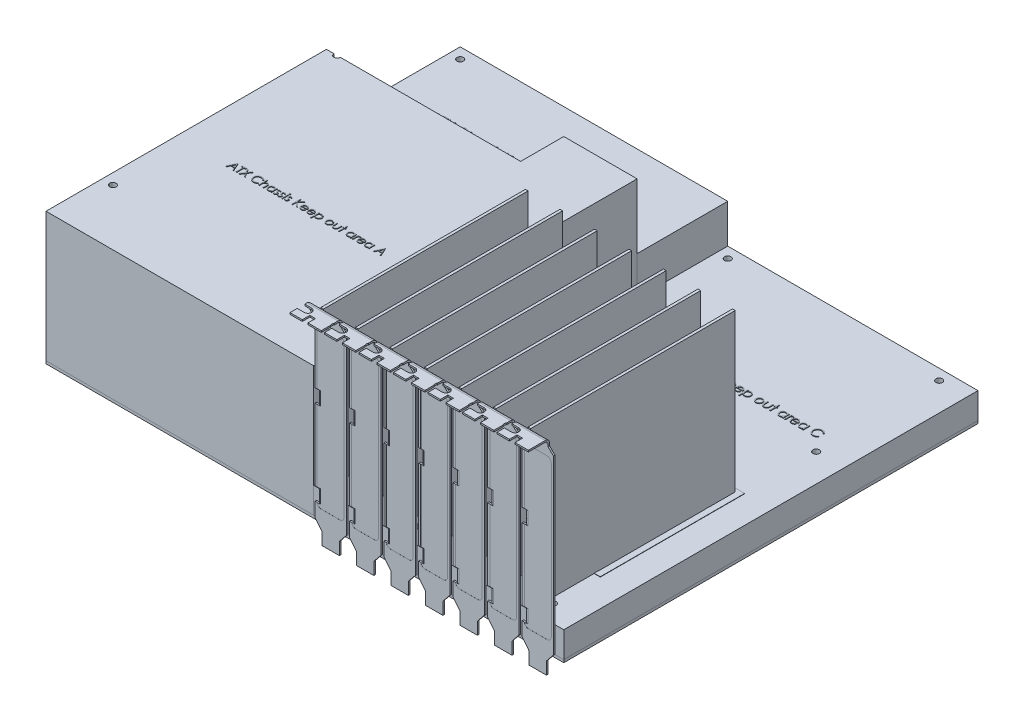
SolidWorks part; units mm, degrees
ref_plane "Front Plane" through (0, 0, 0) normal (0, 0, 1) x (1, 0, 0)
ref_plane "Top Plane" through (0, 0, 0) normal (0, 1, 0) x (1, 0, 0)
ref_plane "Right Plane" through (0, 0, 0) normal (1, 0, 0) x (0, 0, -1)
sketch "MINI ITX" plane through (0, 0, 0) normal (0, 1, 0) x (1, 0, 0)
  line L1 (0, 0) -> (-170, 0)
  line L2 (0, 0) -> (0, 170)
  line L3 (0, 170) -> (-170, 170)
  line L4 (-170, 0) -> (-170, 170)
  dimension "D1" = 170
  dimension "D2" = 170
extrude "MINI-ITX" add sketch "MINI ITX" along normal blind 1.5875
sketch "IO PLATE"
  line L0 (-13.563, 42.3545) -> (-172.567, 42.3545)
  line L1 (-13.69, 42.2275) -> (-172.44, 42.2275) construction
  line L2 (-13.69, 42.2275) -> (-13.69, -2.2225) construction
  line L3 (-13.69, -2.2225) -> (-172.44, -2.2225) construction
  line L4 (-172.44, 42.2275) -> (-172.44, -2.2225) construction
  line L5 (-170, 1.5875) -> (0, 1.5875) construction
  line L6 (-172.567, 42.3545) -> (-172.567, -2.3495)
  line L7 (-13.563, -2.3495) -> (-172.567, -2.3495)
  line L8 (-13.563, 42.3545) -> (-13.563, -2.3495)
other "AlignGroup3" parameters "D1"=0, "D2"=0, "D3"=156.31, "D4"=2.44, "D5"=40.64, "D6"=3.81, "D7"=0.127
other "AlignGroup4"
sketch "Sketch1"
  circle A0 centre (163.83, -33.02) radius 1.905
  circle A1 centre (6.35, -10.16) radius 1.905
  circle A2 centre (6.35, -165.1) radius 1.905
  circle A3 centre (163.83, -165.1) radius 1.905
other "AlignGroup1" parameters "D1"=10.595, "D2"=0, "D3"=0, "D4"=6.35, "D5"=163.4722, "D6"=10.16, "D7"=32.893, "D8"=164.8438
other "AlignGroup2"
extrude "MINI-ITX HOLES" [suppressed] cut sketch "Sketch1" against normal through all
sketch "MICRO ATX" plane through (0, 0, 0) normal (0, 1, 0) x (1, 0, 0)
  line L1 (-170, 0) -> (73.84, 0)
  line L2 (-170, 0) -> (-170, 243.84)
  line L3 (-170, 243.84) -> (73.84, 243.84)
  line L4 (73.84, 0) -> (73.84, 243.84)
  dimension "D1" = 243.84
  dimension "D2" = 243.84
  dimension "D3" = 170
extrude "MICRO-ATX" add sketch "MICRO ATX" along normal blind 1.5875
sketch "Sketch6" plane through (0, 1.5875, 0) normal (0, 1, 0) x (1, 0, 0)
  line L0 (-170, 0) -> (73.84, 0) construction
  line L1 (73.84, 0) -> (-170, 0)
  line L2 (73.84, 0) -> (73.84, 190.5)
  line L3 (73.84, 190.5) -> (-170, 190.5)
  line L4 (-170, 0) -> (-170, 190.5)
  dimension "D1" = 243.84
  dimension "D2" = 190.5
extrude "FLEX-ATX" add sketch "Sketch6" against normal blind 1.5875
sketch "ATX" plane through (0, 0, 0) normal (0, 1, 0) x (1, 0, 0)
  line L1 (-170, 0) -> (134.8, 0)
  line L2 (-170, 0) -> (-170, 243.84)
  line L3 (-170, 243.84) -> (134.8, 243.84)
  line L4 (134.8, 0) -> (134.8, 243.84)
  dimension "D1" = 304.8
  dimension "D2" = 243.84
extrude "ATX-" add sketch "ATX" along normal blind 1.5875
sketch "E ATX" plane through (0, 0, 0) normal (0, 1, 0) x (1, 0, 0)
  line L1 (-170, 0) -> (134.8, 0)
  line L2 (-170, 0) -> (-170, 330.2)
  line L3 (-170, 330.2) -> (134.8, 330.2)
  line L4 (134.8, 0) -> (134.8, 330.2)
  dimension "D1" = 304.8
  dimension "D2" = 330.2
extrude "E-ATX" [suppressed] add sketch "E ATX" along normal blind 1.5875
sketch "Sketch7"
  circle A0 centre (39.37, 10.033) radius 1.905
  circle A1 centre (39.37, 164.8438) radius 1.905
  circle A3 centre (-163.4722, 32.893) radius 1.905
  circle A4 centre (-6.35, 10.033) radius 1.905
  circle A5 centre (-163.4722, 164.8438) radius 1.905
  circle A6 centre (-6.35, 164.8438) radius 1.905
other "AlignGroup9" parameters "D1"=9.7201, "D2"=3.81, "D3"=0, "D4"=0, "D5"=237.3122, "D6"=32.893, "D7"=164.8438, "D8"=10.033, "D9"=80.19
other "AlignGroup10"
extrude "FLEX ATX HOLES" [suppressed] cut sketch "Sketch7" against normal through all
sketch "MINI ATX" plane through (0, 0, 0) normal (0, 1, 0) x (1, 0, 0)
  line L1 (-170, 0) -> (114.48, 0)
  line L2 (-170, 0) -> (-170, 208.28)
  line L3 (-170, 208.28) -> (114.48, 208.28)
  line L4 (114.48, 0) -> (114.48, 208.28)
  dimension "D1" = 284.48
  dimension "D2" = 208.28
  dimension "D3" = 170
sketch "Sketch3" plane through (0, 0, 0) normal (0, 1, 0) x (1, 0, 0)
  line L2 (73.84, 0) -> (73.84, 243.84) construction
  line L5 (-170, 0) -> (114.48, 0) construction
  circle A0 centre (39.55, 10.16) radius 1.905
  circle A1 centre (-6.17, 10.16) radius 1.905
  circle A2 centre (59.87, 165.1) radius 1.905
  circle A3 centre (39.55, 165.1) radius 1.905
  circle A4 centre (-6.17, 165.1) radius 1.905
  circle A5 centre (-6.17, 237.49) radius 1.905
  circle A6 centre (-163.65, 237.49) radius 1.905
  circle A7 centre (-163.65, 165.1) radius 1.905
  circle A8 centre (-163.65, 33.02) radius 1.905
  dimension "D1" = 3.81
  dimension "D2" = 45.72
  dimension "D3" = 34.29
  dimension "D4" = 22.86
  dimension "D5" = 10.16
  dimension "D6" = 203.2
  dimension "D7" = 154.94
  dimension "D8" = 20.32
  dimension "D9" = 227.33
extrude "MICRO-ATX HOLES" [suppressed] cut sketch "Sketch3" along normal through all
sketch "Sketch4"
  line L0 (134.8, 0) -> (134.8, 243.84) construction
  line L1 (-170, 0) -> (134.8, 0) construction
  circle A0 centre (118.29, 10.16) radius 1.905
  circle A1 centre (118.29, 165.1) radius 1.905
  circle A2 centre (118.29, 237.49) radius 1.905
  circle A4 centre (-6.17, 10.16) radius 1.905
  circle A5 centre (-163.65, 33.02) radius 1.905
  circle A6 centre (-163.65, 165.1) radius 1.905
  circle A7 centre (-6.17, 165.1) radius 1.905
  circle A8 centre (-163.65, 237.49) radius 1.905
  circle A9 centre (-6.17, 237.49) radius 1.905
  circle A10 centre (39.55, 10.16) radius 1.905
other "AlignGroup11" parameters "D1"=3.81, "D2"=11.444, "D3"=243.84, "D4"=0, "D5"=140.97, "D6"=298.45, "D7"=33.02, "D8"=165.1, "D9"=237.49, "D10"=10.16, "D11"=78.74, "D12"=16.51
other "AlignGroup12"
extrude "ATX HOLES" cut sketch "Sketch4" against normal through all
sketch "Sketch8" plane through (0, 1.5875, 0) normal (0, 1, 0) x (1, 0, 0)
  line L0 (134.8, 0) -> (134.8, 243.84) construction
  line L1 (-170, 0) -> (134.8, 0) construction
  circle A0 centre (118.29, 10.16) radius 1.905
  circle A1 centre (-6.17, 10.16) radius 1.905
  circle A2 centre (118.29, 165.1) radius 1.905
  circle A3 centre (-6.17, 165.1) radius 1.905
  circle A4 centre (-163.65, 165.1) radius 1.905
  circle A5 centre (-163.65, 33.02) radius 1.905
  circle A6 centre (-163.65, 322.58) radius 1.905
  circle A7 centre (-6.17, 322.58) radius 1.905
  circle A8 centre (123.37, 322.58) radius 1.905
  circle A9 centre (118.29, 237.49) radius 1.905
  circle A10 centre (39.55, 187.96) radius 1.905
  dimension "D1" = 3.81
  dimension "D2" = 16.51
  dimension "D3" = 124.46
  dimension "D4" = 10.16
  dimension "D5" = 154.94
  dimension "D6" = 227.33
  dimension "D7" = 177.8
  dimension "D8" = 5.08
  dimension "D9" = 312.42
  dimension "D10" = 281.94
  dimension "D11" = 22.86
  dimension "D12" = 78.74
extrude "E-ATX HOLES" [suppressed] cut sketch "Sketch8" against normal through all
sketch "Sketch9"
  line L1 (-12.106, 122.555) -> (-3.216, 122.555)
  line L2 (-12.106, 122.555) -> (-12.106, 37.592)
  line L3 (-12.106, 37.592) -> (-3.216, 37.592)
  line L4 (-3.216, 122.555) -> (-3.216, 37.592)
  line L5 (-8.5881, 120.1547) -> (-6.7339, 120.1547)
  line L6 (-8.5881, 120.1547) -> (-8.5881, 105.0925)
  line L7 (-8.5881, 105.0925) -> (-6.7339, 105.0925)
  line L8 (-6.7339, 120.1547) -> (-6.7339, 105.0925)
  line L9 (-6.7339, 103.4923) -> (-8.5881, 103.4923)
  line L10 (-6.7339, 103.4923) -> (-6.7339, 39.9923)
  line L11 (-6.7339, 39.9923) -> (-8.5881, 39.9923)
  line L12 (-8.5881, 103.4923) -> (-8.5881, 39.9923)
other "AlignGroup13" parameters "D1"=0, "D2"=0, "D3"=3.5179, "D4"=5.3721, "D5"=2.4003, "D6"=65.9003, "D7"=67.5005, "D8"=82.5627, "D9"=8.89, "D10"=84.963, "D11"=0, "D12"=0, "D13"=3.216, "D14"=37.592, "D15"=3.216, "D16"=37.592
other "AlignGroup14"
extrude "PCI SLOT 1" add sketch "Sketch9" along normal blind 15.4178
sketch "Sketch11"
  line L1 (-8.4484, 120.6794) -> (-6.8609, 120.6794)
  line L2 (-8.4484, 120.6794) -> (-8.4484, 0.2794)
  line L3 (-8.4484, 0.2794) -> (-6.8609, 0.2794)
  line L4 (-6.8609, 120.6794) -> (-6.8609, 0.2794)
other "AlignGroup15" parameters "D1"=0, "D2"=0, "D3"=6.8609, "D4"=8.4484, "D5"=0.2794, "D6"=120.6794
other "AlignGroup16"
extrude "Extrude1" add sketch "Sketch11" along normal blind 107.7976
sketch "Sketch12"
  line L1 (1.143, 68.1863) -> (-9.0424, 68.1863)
  line L2 (1.143, 68.1863) -> (1.143, 60.3123)
  line L3 (1.143, 60.3123) -> (-9.0424, 60.3123)
  line L4 (-10.3124, 66.9163) -> (-10.3124, 61.5823)
  line L5 (1.143, 18.1483) -> (-9.0424, 18.1483)
  line L6 (1.143, 18.1483) -> (1.143, 10.2743)
  line L7 (1.143, 10.2743) -> (-9.0424, 10.2743)
  line L8 (-10.3124, 16.8783) -> (-10.3124, 11.5443)
  line L11 (-0.2794, 109.3851) -> (-0.2794, 1.5875) construction
  arc A0 (-9.0424, 68.1863) -> (-10.3124, 66.9163) centre (-9.0424, 66.9163) ccw
  arc A1 (-10.3124, 61.5823) -> (-9.0424, 60.3123) centre (-9.0424, 61.5823) ccw
  arc A2 (-10.3124, 16.8783) -> (-9.0424, 18.1483) centre (-9.0424, 16.8783) cw
  arc A3 (-10.3124, 11.5443) -> (-9.0424, 10.2743) centre (-9.0424, 11.5443) ccw
  point P10 (-10.3124, 64.2493)
other "AlignGroup17" parameters "D1"=1.27, "D2"=0, "D3"=0, "D4"=1.143, "D5"=10.3124, "D6"=18.1483, "D7"=60.3123, "D8"=64.2493, "D9"=68.1863
other "AlignGroup18"
extrude "Extrude2" add sketch "Sketch12" along normal blind 0.9144
sketch "Sketch13"
  line L0 (-10.4931, 2.0193) -> (-6.3783, -3.0607)
  line L1 (-10.4931, 103.4923) -> (7.9219, 103.4923) construction
  line L2 (-10.4931, 103.4923) -> (-10.4931, 2.0193)
  line L3 (-10.4931, 2.0193) -> (7.9219, 2.0193) construction
  line L4 (7.9219, 103.4923) -> (7.9219, 2.0193)
  line L5 (-6.3783, -3.0607) -> (-6.3783, -10.2997)
  line L6 (-6.3783, -10.2997) -> (3.8071, -10.2997)
  line L7 (3.8071, -10.2997) -> (3.8071, -3.0607)
  line L8 (3.8071, -3.0607) -> (7.9219, 2.0193)
  line L9 (-10.4931, 103.4923) -> (-13.6681, 106.6673)
  line L10 (-13.6681, 106.6673) -> (-13.6681, 110.6297)
  line L11 (-13.6681, 110.6297) -> (4.7469, 110.6297)
  line L12 (4.7469, 110.6297) -> (4.7469, 106.6673)
  line L13 (4.7469, 106.6673) -> (7.9219, 103.4923)
other "AlignGroup19" parameters "D1"=0, "D2"=0, "D3"=3.8071, "D4"=4.7469, "D5"=7.9219, "D6"=6.3783, "D7"=10.4931, "D8"=13.6681, "D9"=106.6673, "D10"=110.6297, "D11"=3.0607, "D12"=10.2997
other "AlignGroup20"
extrude "Extrude3" add sketch "Sketch13" against normal blind 0.9144
sketch "Sketch14" plane through (0, 0, 1.143) normal (0, 0, 1) x (1, 0, 0)
  line L0 (-13.6681, 110.6297) -> (-13.6681, 106.6673) construction
  line L1 (4.7469, 110.6297) -> (-13.6681, 110.6297)
  line L2 (4.7469, 110.6297) -> (4.7469, 109.7153)
  line L3 (4.7469, 109.7153) -> (-13.6681, 109.7153)
  line L4 (-13.6681, 110.6297) -> (-13.6681, 109.7153)
  dimension "D1" = 0.9144
extrude "Extrude4" add sketch "Sketch14" along normal blind 11.557
sketch "Sketch15"
  line L0 (4.7469, -12.7) -> (-13.6681, -12.7) construction
  line L1 (-6.4291, -8.255) -> (-3.1271, -8.255)
  line L2 (-6.4291, -8.255) -> (-6.4291, -12.7)
  line L3 (-6.4291, -12.7) -> (-3.1271, -12.7)
  line L4 (-3.1271, -8.255) -> (-3.1271, -12.7)
  line L6 (-9.6041, -6.223) -> (-13.6681, -6.223) construction
  line L7 (-9.6041, -4.0132) -> (-13.6681, -4.0132)
  line L8 (-9.6041, -8.4328) -> (-13.6681, -8.4328)
  line L10 (-13.6681, -0.2286) -> (-13.6681, -12.7) construction
  arc A0 (-9.6041, -4.0132) -> (-9.6041, -8.4328) centre (-9.6041, -6.223) cw
  arc A1 (-13.6681, -4.0132) -> (-13.6681, -8.4328) centre (-13.6681, -6.223) ccw
other "AlignGroup21" parameters "D4"=2.2098, "D1"=0, "D3"=0, "D5"=3.1271, "D6"=6.4291, "D7"=9.6041, "D8"=6.223, "D9"=8.255, "D2"=2.2098
other "AlignGroup22"
extrude "Cut-Extrude1" cut sketch "Sketch15" against normal blind 2.54
sketch "Sketch16" plane through (0, 0, 1.143) normal (0, 0, 1) x (1, 0, 0)
  line L0 (-10.4931, 103.4923) -> (-10.4931, 2.0193) construction
  line L1 (-9.3628, 68.1863) -> (-10.4931, 68.1863)
  line L2 (-9.3628, 68.1863) -> (-9.3628, 60.3123)
  line L3 (-9.3628, 60.3123) -> (-10.4931, 60.3123)
  line L4 (-10.4931, 68.1863) -> (-10.4931, 60.3123)
  line L5 (-9.3628, 68.1863) -> (-9.3628, 60.3123) construction
  line L6 (-8.4484, 60.3123) -> (-9.3628, 60.3123) construction
  line L8 (-9.3628, 18.1483) -> (-10.4931, 18.1483)
  line L9 (-9.3628, 18.1483) -> (-9.3628, 10.2743)
  line L10 (-9.3628, 10.2743) -> (-10.4931, 10.2743)
  line L11 (-10.4931, 18.1483) -> (-10.4931, 10.2743)
extrude "Extrude5" cut sketch "Sketch16" against normal blind 2.54
fillet "Fillet1" radius 2.54 3 edges at (-4.4606, 110.6297, 0.2286) (-9.3628, 64.2493, 1.143) (-9.3628, 14.2113, 1.143)
sketch "Sketch17"
  line L0 (4.1119, 101.7396) -> (-6.6831, 101.7396)
  line L1 (6.6519, 10.6044) -> (6.6519, 99.1996)
  line L2 (-6.6831, 8.0644) -> (4.1119, 8.0644)
  line L3 (-9.2231, 99.1996) -> (-9.2231, 10.6044)
  arc A0 (-6.6831, 101.7396) -> (-9.2231, 99.1996) centre (-6.6831, 99.1996) ccw
  arc A1 (6.6519, 99.1996) -> (4.1119, 101.7396) centre (4.1119, 99.1996) ccw
  arc A2 (4.1119, 8.0644) -> (6.6519, 10.6044) centre (4.1119, 10.6044) ccw
  arc A3 (-9.2231, 10.6044) -> (-6.6831, 8.0644) centre (-6.6831, 10.6044) ccw
other "AlignGroup23" parameters "D3"=2.54, "D1"=0, "D2"=0, "D4"=6.6519, "D5"=9.2231, "D6"=8.0644, "D7"=101.7396
other "AlignGroup24"
extrude "Extrude6" cut sketch "Sketch17" against normal blind 0.0254
fillet "Fillet2" radius 1.778 3 edges at (-8.4484, 64.2493, 0.2286) (-8.4484, 14.2113, 0.2286)
pattern_linear "PCI SLOT 2" count 2 spacing 20.32 along (1, 0, 0) of "PCI SLOT 1", "Extrude1", "Extrude2", "Extrude3", "Extrude4", "Cut-Extrude1", "Fillet1", "Fillet2", "Extrude5", "Extrude6"
pattern_linear "PCI SLOT 3" count 2 spacing 40.64 along (1, 0, 0) of "Extrude1", "Extrude2", "Extrude3", "Extrude4", "Cut-Extrude1", "Extrude5", "Fillet1", "Fillet2", "PCI SLOT 1", "Extrude6"
pattern_linear "PCI SLOT 4" count 2 spacing 60.96 along (1, 0, 0) of "Extrude1", "Extrude2", "Extrude3", "Extrude4", "Cut-Extrude1", "Extrude5", "Fillet1", "Fillet2", "PCI SLOT 1", "Extrude6"
pattern_linear "PCI SLOT 5" count 2 spacing 81.28 along (1, 0, 0) of "Extrude1", "Extrude2", "Extrude3", "Extrude4", "Cut-Extrude1", "Extrude5", "Fillet1", "Fillet2", "PCI SLOT 1", "Extrude6"
pattern_linear "PCI SLOT 6" count 2 spacing 101.6 along (1, 0, 0) of "Extrude1", "Extrude2", "Extrude3", "Extrude4", "Cut-Extrude1", "Extrude5", "Fillet1", "Fillet2", "PCI SLOT 1", "Extrude6"
pattern_linear "PCI SLOT 7" count 2 spacing 121.92 along (1, 0, 0) of "Extrude1", "Extrude2", "Extrude3", "Extrude4", "Cut-Extrude1", "Extrude5", "Fillet1", "Fillet2", "PCI SLOT 1", "Extrude6"
sketch "Sketch18" plane through (0, 1.5875, 0) normal (0, 1, 0) x (1, 0, 0)
  line L0 (-170, 0) -> (-170, 165.1)
  line L1 (-170, 0) -> (-170, 170) construction
  line L2 (-170, 165.1) -> (-165.555, 165.1)
  line L3 (-55.7, 165.1) -> (-55.7, 190.5)
  line L4 (-55.7, 190.5) -> (-12.52, 190.5)
  line L5 (-12.52, 190.5) -> (-12.52, 0)
  line L6 (0, 0) -> (-170, 0) construction
  line L7 (-12.52, 0) -> (-170, 0)
  line L8 (134.8, 0) -> (134.8, 243.84) construction
  line L9 (-161.745, 165.1) -> (-55.7, 165.1)
  circle A0 centre (-163.65, 33.02) radius 1.905
  arc A1 (-165.555, 165.1) -> (-161.745, 165.1) centre (-163.65, 165.1) ccw
  circle A2 centre (-163.65, 33.02) radius 1.905 construction
  circle A3 centre (-163.65, 165.1) radius 1.905 construction
  dimension "D1" = 190.5
  dimension "D2" = 165.1
  dimension "D3" = 190.5
  dimension "D4" = 147.32
extrude "ATX Chassis Keep out area A" add sketch "Sketch18" along normal blind 76.2 separate body
sketch "Sketch19" plane through (0, 1.5875, 0) normal (0, 1, 0) x (1, 0, 0)
  line L0 (-12.52, 190.5) -> (-12.52, 243.84)
  line L1 (-170, 243.84) -> (73.84, 243.84) construction
  line L2 (-12.52, 243.84) -> (-170, 243.84)
  line L3 (-170, 243.84) -> (-170, 165.1)
  line L4 (-170, 165.1) -> (-165.555, 165.1)
  line L5 (-55.7, 165.1) -> (-55.7, 190.5)
  line L6 (-55.7, 190.5) -> (-12.52, 190.5)
  line L7 (-161.745, 165.1) -> (-55.7, 165.1)
  arc A0 (-161.745, 165.1) -> (-165.555, 165.1) centre (-163.65, 165.1) ccw
  circle A1 centre (-163.65, 237.49) radius 1.905
  circle A2 centre (-163.65, 237.49) radius 1.905 construction
extrude "ATX Chassis Keep out area B" add sketch "Sketch19" along normal blind 38.1 separate body
sketch "Sketch20" plane through (0, 1.5875, 0) normal (0, 1, 0) x (1, 0, 0)
  line L1 (134.8, 0) -> (-12.52, 0)
  line L2 (134.8, 0) -> (134.8, 243.84)
  line L3 (134.8, 243.84) -> (-12.52, 243.84)
  line L4 (-12.52, 0) -> (-12.52, 243.84)
  circle A0 centre (-6.17, 237.49) radius 1.905
  circle A1 centre (118.29, 237.49) radius 1.905
  circle A2 centre (118.29, 165.1) radius 1.905
  circle A3 centre (-6.17, 165.1) radius 1.905
  circle A4 centre (118.29, 10.16) radius 1.905
  circle A5 centre (39.55, 10.16) radius 1.905
  circle A6 centre (-6.17, 10.16) radius 1.905
  arc A7 (-6.8609, 8.3847) -> (-6.8609, 11.9353) centre (-6.17, 10.16) ccw construction
extrude "ATX Chassis Keep out area C" add sketch "Sketch20" along normal blind 15.24 separate body
sketch "Sketch21" plane through (0, 77.7875, 0) normal (0, 1, 0) x (1, 0, 0)
  text T0 "ATX Chassis Keep out area A" font "Century Gothic" height in points 18
extrude "Boss-Extrude1" add sketch "Sketch21" along normal blind 0.254 separate body
sketch "Sketch22" plane through (0, 39.6875, 0) normal (0, 1, 0) x (-1, 0, 0)
  line L0 (147.6503, -198.1804) -> (41.4766, -198.1804) construction
  text T1 "ATX Chassis Keep out area B" font "Century Gothic" height in points 20
extrude "Boss-Extrude2" add sketch "Sketch22" along normal blind 0.254 separate body
sketch "Sketch23" plane through (0, 16.8275, 0) normal (0, 1, 0) x (1, 0, 0)
  line L0 (112.0742, 172.2779) -> (5.1268, 172.2779) construction
  text T0 "ATX Chassis Keep out area C" font "Century Gothic" height in points 20
extrude "Boss-Extrude3" add sketch "Sketch23" along normal blind 0.254 separate body
